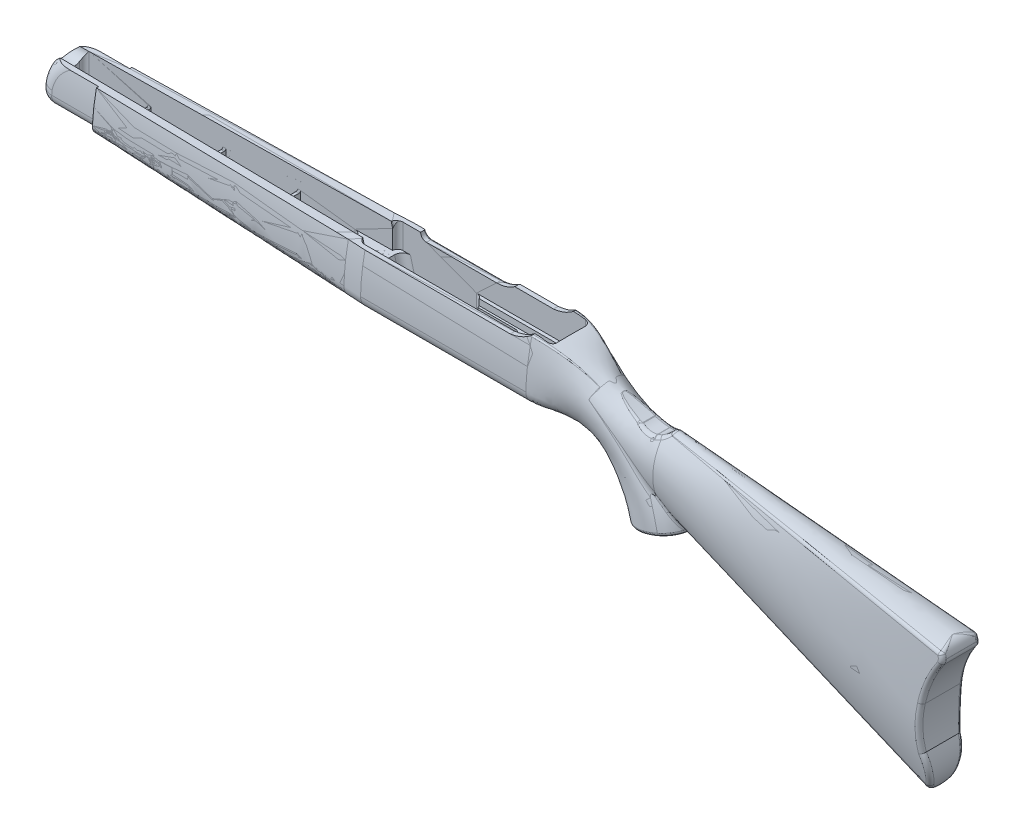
SolidWorks part; units mm, degrees
ref_plane "Front Plane" through (0, 0, 0) normal (0, 0, 1) x (1, 0, 0)
ref_plane "Top Plane" through (0, 0, 0) normal (0, 1, 0) x (1, 0, 0)
ref_plane "Right Plane" through (0, 0, 0) normal (1, 0, 0) x (0, 0, -1)
imported_body "Imported1"
imported_body "Imported2"
imported_body "Imported3"
imported_body "Surface-Imported1"
sketch "Sketch1" plane through (0, 15.868, 0) normal (0, -1, 0) x (1, 0, 0)
  circle A0 centre (-488.2553, 0) radius 4.191
extrude "Cut-Extrude1" cut sketch "Sketch1" against normal up to surface
sketch "Sketch2" plane through (0, 31.9462, 0) normal (0, 1, 0) x (-1, 0, 0)
  circle A0 centre (488.2553, 0) radius 3.2385
extrude "Cut-Extrude2" cut sketch "Sketch2" against normal blind 14.1732
sketch "Sketch3" plane through (0, 17.773, 0) normal (0, 1, 0) x (-1, 0, 0)
  circle A0 centre (488.2553, 0) radius 2.2352
extrude "Cut-Extrude3" cut sketch "Sketch3" against normal up to next
draft "Draft1" type of draft neutral plane draft angle 0.8 faces to draft 3 parameters "D1"=0.8
draft "Draft2" type of draft neutral plane draft angle 0.8 faces to draft 3 parameters "D1"=0.8
sketch3d "3DSketch1"
  line L0 (-721.4755, 52.1392, -8.1534) -> (-728.1494, 52.1392, -8.1534)
  line L1 (-477.3961, 52.1392, -11.6066) -> (-720.8963, 52.1392, -8.2059)
  line L2 (-728.1494, 52.1392, 8.1534) -> (-721.4755, 52.1392, 8.1534)
  line L3 (-720.8963, 52.1392, 8.2059) -> (-477.3961, 52.1392, 11.6066)
  line L4 (-715.1562, 52.1392, -12.7) -> (-692.0885, 52.1392, -12.7)
  line L5 (-692.0885, 52.1392, -12.7) -> (-692.0885, 52.1392, -14.5172)
  line L6 (-692.0885, 19.3224, 10.7966) -> (-692.0885, 19.3224, -10.7966)
  line L7 (-692.0885, 21.1004, -7.62) -> (-692.0885, 21.1004, 7.62)
  line L8 (-692.0885, 52.1392, 12.7) -> (-715.1562, 52.1392, 12.7)
  line L9 (-692.0885, 52.1392, 14.5172) -> (-692.0885, 52.1392, 12.7)
  line L10 (-482.0305, 52.1392, 18.7325) -> (-692.0885, 52.1392, 14.5172)
  line L11 (-692.0885, 52.1392, -14.5172) -> (-482.0305, 52.1392, -18.7325)
  line L12 (-467.6541, 52.1392, 19.558) -> (-482.0305, 52.1392, 18.7325)
  line L13 (-332.6028, 52.1392, 15.748) -> (-472.0501, 52.1392, 15.748)
  line L14 (-467.6541, 52.1392, 19.558) -> (-332.6028, 52.1392, 19.558)
  line L15 (-482.0305, 52.1392, -18.7325) -> (-467.6541, 52.1392, -19.558)
  line L16 (-458.2296, 52.1392, -19.558) -> (-467.6541, 52.1392, -19.558)
  line L17 (-472.0501, 52.1392, -15.748) -> (-457.4699, 52.1392, -15.748)
  line L18 (-452.7201, 47.3894, -15.748) -> (-395.3161, 47.3894, -15.748)
  line L19 (-457.4699, 52.1392, -18.7797) -> (-457.4699, 52.1392, -15.748)
  line L20 (-380.4825, 52.1392, -15.748) -> (-332.6028, 52.1392, -15.748)
  line L21 (-380.4825, 52.1392, -15.748) -> (-380.4825, 52.1392, -18.9091)
  line L22 (-332.6028, 52.1392, -19.558) -> (-379.4101, 52.1392, -19.558)
  line L23 (-332.6028, 52.1392, -15.748) -> (-348.9215, 52.1432, -15.748)
  line L24 (-332.6028, 58.5683, -15.748) -> (-332.6028, 58.5683, -17.0831)
  line L25 (-332.6028, 58.5683, 17.0831) -> (-332.6028, 58.5683, 15.748)
  line L26 (-318.8373, 31.9462, 11.684) -> (-318.8373, 31.9462, -11.684)
  line L27 (-411.7505, 31.9462, 15.748) -> (-322.9013, 31.9462, 15.748)
  line L28 (-325.7461, 31.9462, 12.9032) -> (-406.813, 31.9462, 12.9032)
  line L29 (-406.813, 31.9462, 12.9032) -> (-406.813, 26.917, 12.9032)
  line L30 (-325.7461, 26.917, 12.9032) -> (-406.813, 26.917, 12.9032)
  line L31 (-406.1625, 26.917, 11.2014) -> (-375.7333, 26.917, 11.2014)
  line L32 (-406.1625, 26.917, 11.2014) -> (-406.1625, 10.5594, 11.2014)
  line L33 (-375.7333, 10.5594, 11.2014) -> (-406.1625, 10.5594, 11.2014)
  line L34 (-371.9233, 26.917, 9.3726) -> (-371.9233, 10.5594, 9.3726)
  line L35 (-375.7333, 10.5594, 11.2014) -> (-375.7333, 26.917, 11.2014)
  line L36 (-330.2927, 26.917, 9.3726) -> (-371.9233, 26.917, 9.3726)
  line L37 (-371.9233, 10.5594, 9.3726) -> (-332.6028, 10.5594, 9.3726)
  line L38 (-321.6821, 31.9462, -8.8392) -> (-321.6821, 31.9462, 8.8392)
  line L39 (-321.6821, 26.917, 3.7018) -> (-321.6821, 26.917, 8.8392)
  line L40 (-406.813, 31.9462, -12.9032) -> (-325.7461, 31.9462, -12.9032)
  line L41 (-322.9013, 31.9462, -15.748) -> (-411.7505, 31.9462, -15.748)
  line L42 (-321.6821, 26.917, -8.8392) -> (-321.6821, 26.917, -3.7018)
  line L43 (-371.9233, 26.917, -9.3726) -> (-330.2927, 26.917, -9.3726)
  line L44 (-406.813, 26.917, -12.9032) -> (-325.7461, 26.917, -12.9032)
  line L45 (-406.1625, 26.917, -11.2014) -> (-375.7333, 26.917, -11.2014)
  line L46 (-406.813, 26.917, -12.9032) -> (-406.813, 31.9462, -12.9032)
  line L47 (-406.1625, 10.5594, -11.2014) -> (-406.1625, 26.917, -11.2014)
  line L48 (-411.7505, 31.9462, -15.748) -> (-411.7505, 10.9505, -15.748)
  line L49 (-375.7333, 26.917, -11.2014) -> (-375.7333, 10.5594, -11.2014)
  line L50 (-371.9233, 10.5594, -9.3726) -> (-371.9233, 26.917, -9.3726)
  line L51 (-406.1625, 10.5594, -11.2014) -> (-375.7333, 10.5594, -11.2014)
  line L52 (-371.9233, 10.5594, -9.3726) -> (-332.6028, 10.5594, -9.3726)
  line L53 (-330.2927, 10.554, -9.3726) -> (-332.6028, 10.5594, -9.3726)
  line L54 (-332.6028, 10.5594, 9.3726) -> (-330.2927, 10.554, 9.3726)
  line L55 (-330.2927, 10.554, 9.3726) -> (-330.2927, 26.917, 9.3726)
  line L56 (-330.2927, 26.917, -9.3726) -> (-330.2927, 10.554, -9.3726)
  line L57 (-411.7505, 10.9505, 15.748) -> (-411.7505, 31.9462, 15.748)
  line L58 (-460.3153, 10.9505, 15.748) -> (-411.7505, 10.9505, 15.748)
  line L59 (-465.8219, 31.9462, 15.748) -> (-460.3153, 11.3954, 15.748)
  line L60 (-472.0501, 31.9462, 15.748) -> (-465.8219, 31.9462, 15.748)
  line L61 (-472.0501, 52.1392, 15.748) -> (-472.0501, 31.9462, 15.748)
  line L62 (-476.1649, 31.9462, 11.6238) -> (-476.1649, 47.569, 11.6238)
  line L63 (-476.1649, 47.569, 11.6238) -> (-477.3961, 52.1392, 11.6066)
  line L64 (-477.3961, 52.1392, -11.6066) -> (-476.1649, 47.569, -11.6238)
  line L65 (-476.1649, 47.569, -11.6238) -> (-476.1649, 31.9462, -11.6238)
  line L66 (-472.3959, 31.9462, 9.398) -> (-472.3959, 31.9462, -9.398)
  line L67 (-467.2404, 12.7055, 9.398) -> (-472.3959, 31.9462, 9.398)
  line L68 (-465.8219, 31.9462, -15.748) -> (-472.0501, 31.9462, -15.748)
  line L69 (-472.0501, 31.9462, -15.748) -> (-472.0501, 52.1392, -15.748)
  line L70 (-460.3153, 11.3954, -15.748) -> (-465.8219, 31.9462, -15.748)
  line L71 (-472.3959, 31.9462, -9.398) -> (-467.2404, 12.7055, -9.398)
  line L72 (-460.3153, 10.9505, -15.748) -> (-460.3153, 11.3954, -15.748)
  line L73 (-411.7505, 10.9505, -15.748) -> (-460.3153, 10.9505, -15.748)
  line L74 (-460.3153, 11.3954, 15.748) -> (-460.3153, 10.9505, 15.748)
  spline S0 degree 1 poles (-735.2343, 44.6972, 3.3309) (-728.1494, 52.1392, 8.1534) knots 0 0 1 1
  spline S1 degree 1 poles (-735.2343, 44.6972, -3.3309) (-735.2343, 44.6972, 3.3309) knots 0 0 1 1
  spline S2 degree 1 poles (-728.1494, 52.1392, -8.1534) (-735.2343, 44.6972, -3.3309) knots 0 0 1 1
  spline S3 degree 1 poles (-728.1494, 52.1392, -8.1534) (-715.1562, 52.1392, -12.7) knots 0 0 1 1
  spline S4 degree 1 poles (-692.0885, 19.3224, -10.7966) (-692.0885, 52.1392, -14.5172) knots 0 0 1 1
  spline S5 degree 1 poles (-692.0885, 52.1392, 14.5172) (-692.0885, 19.3224, 10.7966) knots 0 0 1 1
  spline S6 degree 1 poles (-715.1562, 52.1392, 12.7) (-728.1494, 52.1392, 8.1534) knots 0 0 1 1
  spline S7 degree 1 poles (-477.3961, 52.1392, 11.6066) (-474.65, 52.1392, 14.8226) knots 0 0 1 1
  spline S8 degree 1 poles (-474.65, 52.1392, -14.8226) (-477.3961, 52.1392, -11.6066) knots 0 0 1 1
  spline S9 degree 1 poles (-458.2296, 52.1392, -19.558) (-457.4698, 52.1392, -18.7797) knots 0 0 1 1
  spline S10 degree 1 poles (-380.4825, 52.1392, -18.9091) (-379.4101, 52.1392, -19.558) knots 0 0 1 1
  spline S11 degree 1 poles (-333.9334, 57.6002, -18.3167) (-348.9215, 52.1432, -19.5572) knots 0 0 1 1
  spline S12 degree 1 poles (-333.9334, 57.6002, -18.3167) (-332.6028, 58.5683, -17.0831) knots 0 0 1 1
  spline S13 degree 1 poles (-332.6028, 58.5683, -15.748) (-322.9013, 57.6965, -15.748) knots 0 0 1 1
  spline S14 degree 1 poles (-322.9013, 57.6965, -15.748) (-318.8373, 56.9326, -11.684) knots 0 0 1 1
  spline S15 degree 1 poles (-318.8373, 56.9326, -11.684) (-318.8373, 56.9326, 11.684) knots 0 0 1 1
  spline S16 degree 1 poles (-318.8373, 56.9326, 11.684) (-322.9013, 57.6965, 15.748) knots 0 0 1 1
  spline S17 degree 1 poles (-322.9013, 57.6965, 15.748) (-332.6028, 58.5683, 15.748) knots 0 0 1 1
  spline S18 degree 1 poles (-332.6028, 58.5683, 17.0831) (-333.9334, 57.6002, 18.3167) knots 0 0 1 1
  spline S19 degree 1 poles (-348.9215, 52.1432, 19.5572) (-333.9334, 57.6002, 18.3167) knots 0 0 1 1
  spline S20 degree 1 poles (-330.2927, 10.554, 9.3726) (-330.2927, 10.554, -9.3726) knots 0 0 1 1
  spline S21 degree 1 poles (-411.7505, 10.9505, -15.748) (-406.8416, 10.5594, -12.952) knots 0 0 1 1
  spline S22 degree 1 poles (-406.8416, 10.5594, 12.952) (-411.7505, 10.9505, 15.748) knots 0 0 1 1
  spline S23 degree 1 poles (-460.3153, 11.3954, 15.748) (-466.6645, 10.564, 9.5758) knots 0 0 1 1
  spline S24 degree 1 poles (-472.3959, 31.9462, 9.398) (-465.8219, 31.9462, 15.748) knots 0 0 1 1
  spline S25 degree 1 poles (-476.1649, 47.569, 11.6238) (-474.65, 52.1392, 14.8226) knots 0 0 1 1
  spline S26 degree 1 poles (-466.7717, 10.9658, 9.5752) (-467.2404, 12.7055, 9.398) knots 0 0 1 1
  spline S27 degree 1 poles (-467.2404, 12.7055, 9.398) (-467.2404, 12.7055, -9.398) knots 0 0 1 1
  spline S28 degree 1 poles (-472.3959, 31.9462, -9.398) (-465.8219, 31.9462, -15.748) knots 0 0 1 1
  spline S29 degree 1 poles (-467.2404, 12.7055, -9.398) (-466.7717, 10.9658, -9.5752) knots 0 0 1 1
  spline S30 degree 1 poles (-466.6645, 10.564, -9.5758) (-460.3153, 11.3954, -15.748) knots 0 0 1 1
  spline S31 degree 1 poles (-465.5776, 10.5594, -12.952) (-460.3153, 10.9505, -15.748) knots 0 0 1 1
  spline S32 degree 1 poles (-460.3153, 10.9505, 15.748) (-465.5776, 10.5594, 12.952) knots 0 0 1 1
